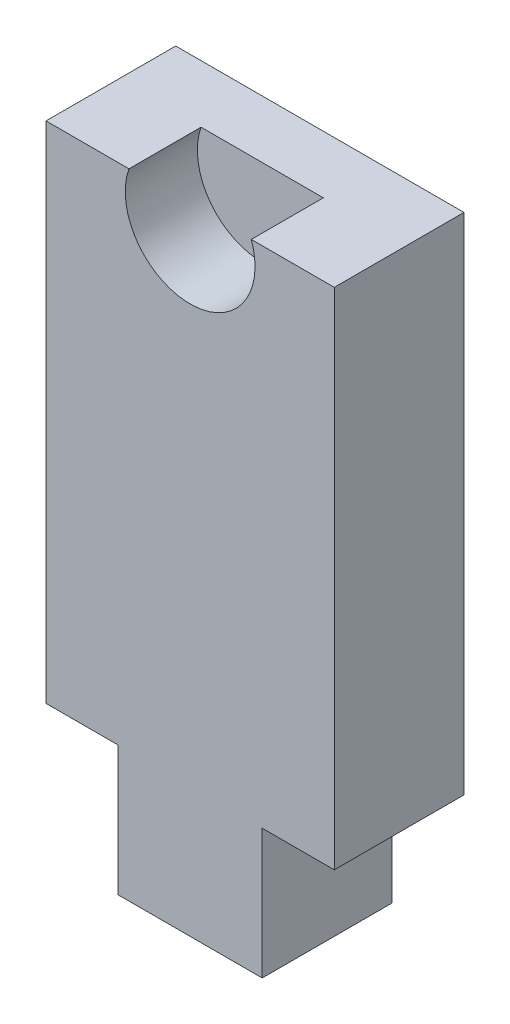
SolidWorks part; units mm, degrees
ref_plane "Front Plane" through (0, 0, 0) normal (0, 0, 1) x (1, 0, 0)
ref_plane "Top Plane" through (0, 0, 0) normal (0, 1, 0) x (1, 0, 0)
ref_plane "Right Plane" through (0, 0, 0) normal (1, 0, 0) x (0, 0, -1)
sketch "Sketch1" plane through (0, 0, 0) normal (0, 0, 1) x (1, 0, 0)
  line L1 (-20, -35) -> (20, -35)
  line L2 (-20, -35) -> (-20, 35)
  line L3 (-20, 35) -> (20, 35)
  line L4 (20, -35) -> (20, 35)
  line L5 (-20, -35) -> (20, 35) construction
  line L6 (-20, 35) -> (20, -35) construction
  point P0 (0, 0)
  dimension "D1" = 70
  dimension "D2" = 40
extrude "Boss-Extrude1" add sketch "Sketch1" along normal blind 18
sketch "Sketch2" plane through (0, 0, 18) normal (0, 0, 1) x (1, 0, 0)
  line L0 (0, 35) -> (0, 32.0021) construction
  line L2 (20, 35) -> (-20, 35) construction
  circle A0 centre (0, 32.0021) radius 9
  dimension "D2" = 18
  dimension "D1" = 2.9979
extrude "Cut-Extrude1" cut sketch "Sketch2" against normal blind 10
sketch "Sketch3" plane through (0, 0, 18) normal (0, 0, 1) x (1, 0, 0)
  line L0 (-20, -35) -> (20, -35) construction
  line L1 (-10, -53) -> (10, -53)
  line L2 (-10, -53) -> (-10, -35)
  line L4 (10, -53) -> (10, -35)
  line L5 (-10, -53) -> (0, -35) construction
  line L6 (0, -35) -> (10, -53) construction
  line L7 (-10, -35) -> (10, -35)
  point P0 (0, -35)
  dimension "D1" = 18
  dimension "D2" = 20
extrude "Boss-Extrude2" add sketch "Sketch3" against normal blind 18
